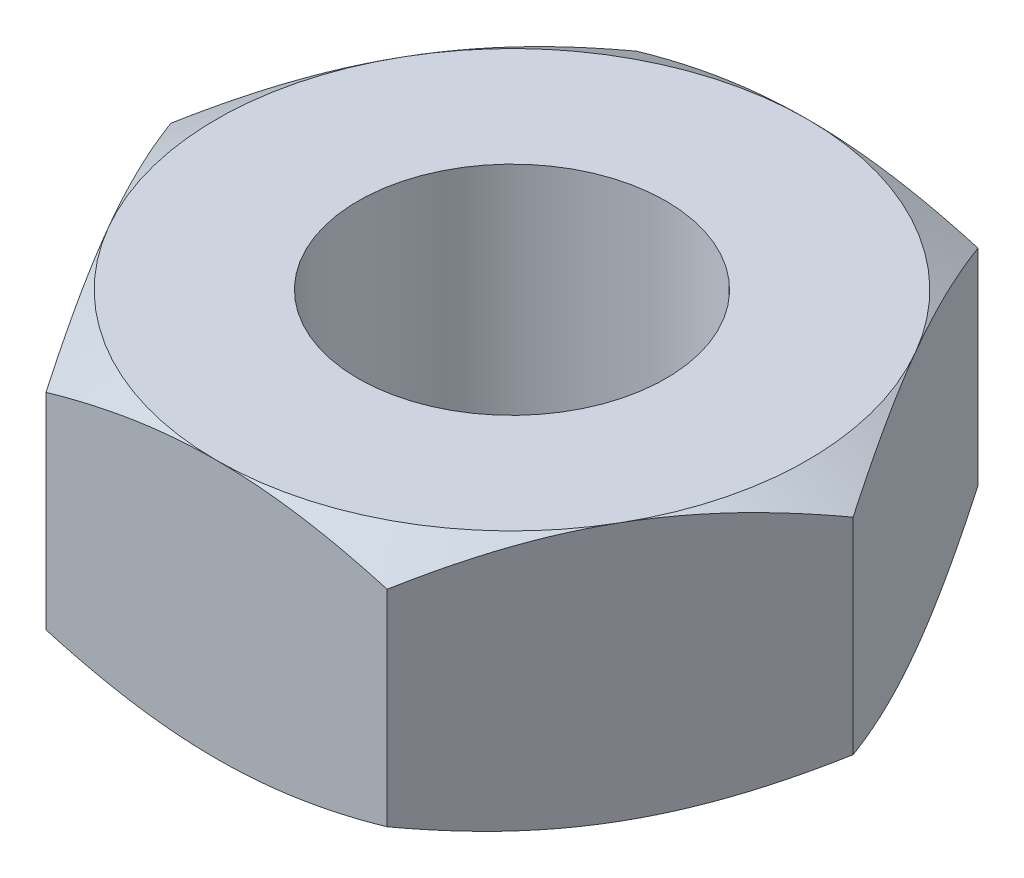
SolidWorks part; units mm, degrees
ref_plane "Front" through (0, 0, 0) normal (0, 0, 1) x (1, 0, 0)
ref_plane "Top" through (0, 0, 0) normal (0, 1, 0) x (1, 0, 0)
ref_plane "Right" through (0, 0, 0) normal (1, 0, 0) x (0, 0, -1)
sketch "Sketch1" plane through (0, 0, 0) normal (0, 1, 0) x (1, 0, 0)
  line L1 (5.5426, 0) -> (2.7713, 4.8)
  line L2 (2.7713, 4.8) -> (-2.7713, 4.8)
  line L3 (-2.7713, 4.8) -> (-5.5426, 0)
  line L4 (-5.5426, 0) -> (-2.7713, -4.8)
  line L5 (-2.7713, -4.8) -> (2.7713, -4.8)
  line L6 (2.7713, -4.8) -> (5.5426, 0)
  circle A0 centre (0, 0) radius 4.8 construction
  dimension "D1" = 9.6
extrude "Boss-Extrude1" add sketch "Sketch1" along normal blind 4.2
sketch "Sketch2" plane through (0, 4.2, 0) normal (0, 1, 0) x (1, 0, 0)
  line L0 (2.7713, -4.8) -> (5.5426, 0) construction
  circle A0 centre (0, 0) radius 4.8
extrude "Cut-Extrude1" cut sketch "Sketch2" against normal blind 8 draft 60 flip side to cut
sketch "Sketch3" plane through (0, 0, 0) normal (0, -1, 0) x (-1, 0, 0)
  line L0 (2.7713, 4.8) -> (5.5426, 0) construction
  circle A0 centre (0, 0) radius 4.8
extrude "Cut-Extrude2" cut sketch "Sketch3" against normal blind 8 draft 60 flip side to cut
hole_wizard "M6x1.0 Tapped Hole1" positions "Sketch4" profile "Sketch5" tap size "M6x1.0" standard "ANSI Metric"
sketch "Sketch4" plane through (0, 4.2, 0) normal (0, 1, 0) x (1, 0, 0)
  point P0 (0, 0)
sketch "Sketch5" plane through (0, 4.2, 0) normal (1, 0, 0) x (0, 0, 1)
  line L0 (0, 0) -> (0, 4.2)
  line L1 (0, 4.2) -> (2.5, 4.2)
  line L2 (2.5, 4.2) -> (2.5, 0)
  line L5 (2.5, 0) -> (0, 0)
  line L11 (0, -6.35) -> (0, 107.95) construction
  dimension "Thru Tap Drill Dia." = 5
  dimension "Thru Tap Drill Depth" = 4.2
